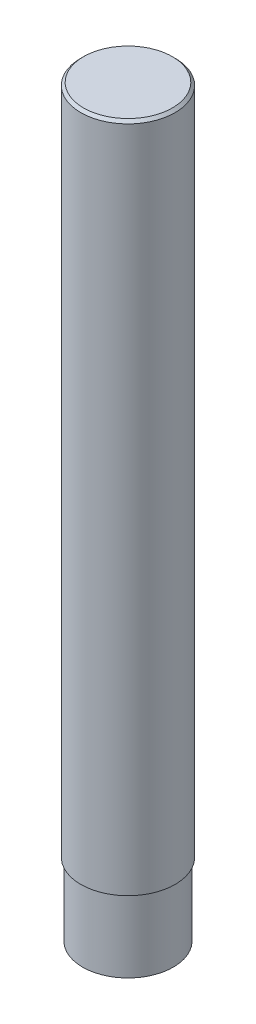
SolidWorks part; units mm, degrees
ref_plane "Face" through (0, 0, 0) normal (0, 0, 1) x (1, 0, 0)
ref_plane "Dessus" through (0, 0, 0) normal (0, 1, 0) x (1, 0, 0)
ref_plane "Droite" through (0, 0, 0) normal (1, 0, 0) x (0, 0, -1)
sketch "Esquisse1" plane through (0, 0, 0) normal (1, 0, 0) x (0, 0, -1)
  line L0 (0, 41.077) -> (0, -20.7481) construction
  line L1 (5, 0) -> (5, -8)
  line L2 (5, -8) -> (0, -8)
  line L3 (0, -8) -> (0, 74)
  line L4 (0, 74) -> (4.9, 74)
  line L5 (5.2, 73.7) -> (5.2, 0)
  line L6 (5.2, 0) -> (5, 0)
  line L7 (4.9, 74) -> (5.2, 73.7)
  point P8 (5.2, 74)
  dimension "D1" = 5
  dimension "D2" = 5.2
  dimension "D3" = 8
  dimension "D4" = 82
  dimension "D7" = 0.3
revolve "Révolution1" add sketch "Esquisse1" angle 360 about L0
